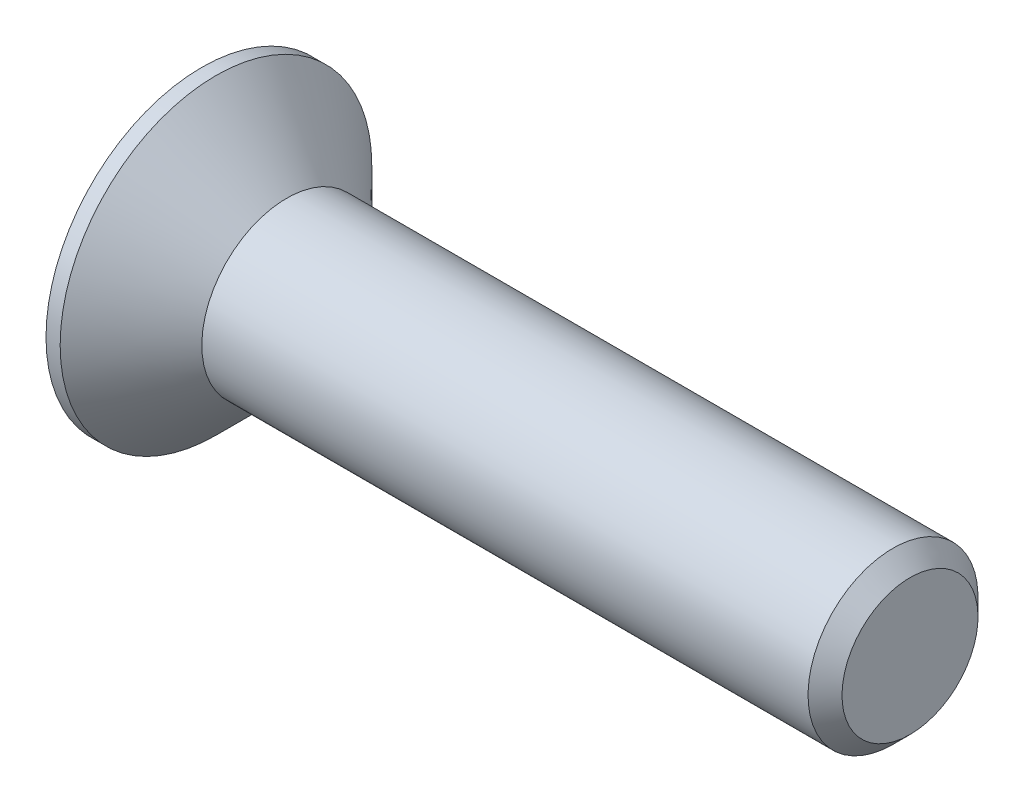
SolidWorks part; units mm, degrees
ref_plane "Front Plane" through (0, 0, 0) normal (0, 0, 1) x (1, 0, 0)
ref_plane "Top Plane" through (0, 0, 0) normal (0, 1, 0) x (1, 0, 0)
ref_plane "Right Plane" through (0, 0, 0) normal (1, 0, 0) x (0, 0, -1)
sketch "Sketch1" plane through (0, 0, 0) normal (0, 0, 1) x (1, 0, 0)
  line L1 (-3, 5.5) -> (-3, 0)
  line L2 (-3, 0) -> (22, 0)
  line L3 (22, 0) -> (22, 3)
  line L4 (22, 3) -> (0, 3)
  line L5 (-3, 5.5) -> (-2.5, 5.5)
  line L6 (-2.5, 5.5) -> (0, 3)
  dimension "D1" = 3
  dimension "D2" = 45
  dimension "D3" = 3
  dimension "D4" = 25
  dimension "D5" = 5.5
revolve "Revolve1" add sketch "Sketch1" angle 360 about L2
chamfer "Chamfer1" distance 0.6 angle 45 1 edges at (22, -3, 0)
sketch "Sketch2" plane through (-3, 0, 0) normal (-1, 0, 0) x (0, 0, 1)
  line L0 (-0.825, 3.3) -> (0.825, 3.3)
  line L1 (0.825, 3.3) -> (0.825, 0.825)
  line L2 (0.825, 0.825) -> (3.3, 0.825)
  line L3 (3.3, 0.825) -> (3.3, -0.825)
  line L4 (3.3, -0.825) -> (0.825, -0.825)
  line L5 (0.825, -0.825) -> (0.825, -3.3)
  line L6 (0.825, -3.3) -> (-0.825, -3.3)
  line L7 (-0.825, -3.3) -> (-0.825, -0.825)
  line L8 (-0.825, -0.825) -> (-3.3, -0.825)
  line L9 (-3.3, -0.825) -> (-3.3, 0.825)
  line L10 (-3.3, 0.825) -> (-0.825, 0.825)
  line L11 (-0.825, 0.825) -> (-0.825, 3.3)
  point P2 (0, 3.3)
  point P14 (0, -3.3)
  point P15 (3.3, 0)
  point P16 (-3.3, 0)
  dimension "D1" = 6.6
  dimension "D2" = 1.65
extrude "Cut-Extrude1" cut sketch "Sketch2" against normal blind 2.5
